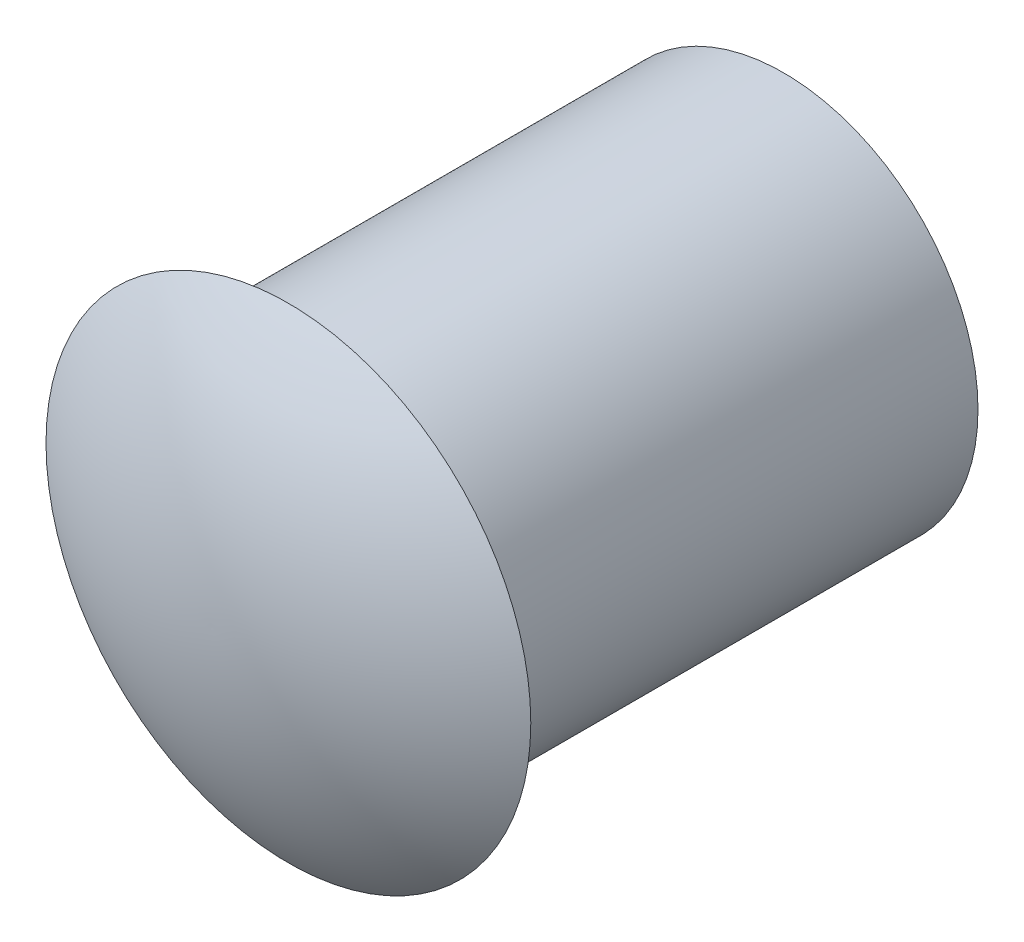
SolidWorks part; units mm, degrees
ref_plane "Front Plane" through (0, 0, 0) normal (0, 0, 1) x (1, 0, 0)
ref_plane "Top Plane" through (0, 0, 0) normal (0, 1, 0) x (1, 0, 0)
ref_plane "Right Plane" through (0, 0, 0) normal (1, 0, 0) x (0, 0, -1)
sketch "Sketch1" plane through (0, 0, 0) normal (0, 0, 1) x (1, 0, 0)
  circle A0 centre (0, 0) radius 2.9925
extrude "Boss-Extrude1" add sketch "Sketch1" against normal blind 7.62
sketch "Sketch2" plane through (0, 0, 0) normal (0, 1, 0) x (1, 0, 0)
  line L0 (-3.7303, 0) -> (0, 0)
  line L1 (0, 0) -> (0, -1.1808)
  arc A0 (0, -1.1808) -> (-3.7303, 0) centre (-0.0452, 5.159) cw
revolve "Revolve1" add sketch "Sketch2" angle 360 about L1
